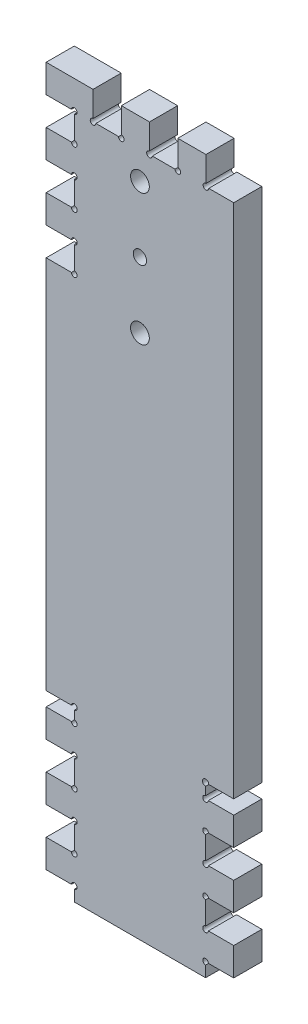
SolidWorks part; units mm, degrees
ref_plane "Ebene vorne" through (0, 0, 0) normal (0, 0, 1) x (1, 0, 0)
ref_plane "Ebene oben" through (0, 0, 0) normal (0, 1, 0) x (1, 0, 0)
ref_plane "Ebene rechts" through (0, 0, 0) normal (1, 0, 0) x (0, 0, -1)
sketch "Skizze1" plane through (0, 0, 0) normal (0, 0, 1) x (1, 0, 0)
  line L0 (0, 82.6) -> (13.5, 82.6)
  line L1 (0, 365.2705) -> (13.5, 365.2705)
  line L2 (15, 84.1) -> (15, 88.6)
  line L5 (0, 82.6) -> (0, 67.6)
  line L6 (0, 67.6) -> (13.5, 67.6)
  line L7 (15, 66.1) -> (15, 54)
  line L8 (13.5, 52.5) -> (0, 52.5)
  line L9 (0, 52.5) -> (0, 37.5)
  line L10 (0, 37.5) -> (13.5, 37.5)
  line L11 (15, 36) -> (15, 23.9)
  line L12 (85, 88.4) -> (85, 84.1)
  line L13 (0, 22.4) -> (0, 7.4)
  line L14 (13.5, 22.4) -> (0, 22.4)
  line L15 (0, 7.4) -> (13.5, 7.4)
  line L16 (86.7, 90.1) -> (100, 90.1)
  line L17 (86.5, 82.6) -> (100, 82.6)
  line L18 (100, 67.6) -> (86.5, 67.6)
  line L19 (85, 66.1) -> (85, 54)
  line L20 (86.5, 52.5) -> (100, 52.5)
  line L21 (100, 52.5) -> (100, 37.5)
  line L22 (100, 37.5) -> (86.5, 37.5)
  line L23 (85, 36) -> (85, 23.9)
  line L24 (100, 82.6) -> (100, 67.6)
  line L25 (86.5, 22.4) -> (100, 22.4)
  line L26 (100, 7.4) -> (86.5, 7.4)
  line L27 (100, 22.4) -> (100, 7.4)
  line L29 (15, 5.9) -> (15, 0)
  line L30 (85, 5.9) -> (85, 0)
  line L31 (85, 0) -> (15, 0)
  line L32 (0, 289.9705) -> (0, 90.1)
  line L33 (0, 90.1) -> (13.5, 90.1)
  line L34 (100, 90.1) -> (100, 365.4)
  line L35 (15, 291.4705) -> (15, 303.5705)
  line L36 (13.5, 350.1705) -> (0, 350.1705)
  line L37 (0, 305.0705) -> (0, 320.0705)
  line L39 (15, 321.5705) -> (15, 333.6705)
  line L40 (0, 335.1705) -> (13.5, 335.1705)
  line L41 (0, 335.1705) -> (0, 350.1705)
  line L42 (13.5, 320.0705) -> (0, 320.0705)
  line L43 (15, 351.6705) -> (15, 363.7705)
  line L44 (0, 305.0705) -> (13.5, 305.0705)
  line L45 (0, 365.2705) -> (0, 380.2705)
  line L46 (0, 380.2705) -> (25, 380.2705)
  line L47 (26.5, 365.2705) -> (38.6, 365.2705)
  line L48 (40.1, 366.7705) -> (40.1, 380.2705)
  line L49 (55.1, 380.2705) -> (54.9689, 366.7648)
  line L50 (40.1, 380.2705) -> (55.1, 380.2705)
  line L51 (56.6, 365.2705) -> (68.7, 365.2705)
  line L52 (70.2, 366.7705) -> (70.2, 380.2705)
  line L53 (85.2, 380.2705) -> (85.2, 366.9)
  line L54 (70.2, 380.2705) -> (85.2, 380.2705)
  line L55 (86.7, 365.4) -> (100, 365.4)
  line L56 (25, 366.7705) -> (25, 380.2705)
  line L57 (13.5, 289.9705) -> (0, 289.9705)
  arc A0 (13.5, 82.6) -> (15, 84.1) centre (15, 82.6) ccw
  arc A1 (13.5, 67.6) -> (15, 66.1) centre (15, 67.6) cw
  arc A2 (15, 54) -> (13.5, 52.5) centre (15, 52.5) cw
  arc A3 (13.5, 37.5) -> (15, 36) centre (15, 37.5) cw
  arc A4 (15, 23.9) -> (13.5, 22.4) centre (15, 22.4) cw
  arc A5 (13.5, 7.4) -> (15, 5.9) centre (15, 7.4) cw
  arc A6 (85, 84.1) -> (86.5, 82.6) centre (85, 82.6) ccw
  arc A7 (86.5, 67.6) -> (85, 66.1) centre (85, 67.6) ccw
  arc A8 (85, 54) -> (86.5, 52.5) centre (85, 52.5) ccw
  arc A9 (86.5, 37.5) -> (85, 36) centre (85, 37.5) ccw
  arc A10 (85, 23.9) -> (86.5, 22.4) centre (85, 22.4) ccw
  arc A11 (86.5, 7.4) -> (85, 5.9) centre (85, 7.4) ccw
  arc A12 (13.5, 289.9705) -> (15, 291.4705) centre (15, 289.9705) ccw
  arc A13 (13.5, 305.0705) -> (15, 303.5705) centre (15, 305.0705) cw
  arc A14 (13.5, 320.0705) -> (15, 321.5705) centre (15, 320.0705) ccw
  arc A15 (15, 333.6705) -> (13.5, 335.1705) centre (15, 335.1705) ccw
  arc A16 (13.5, 350.1705) -> (15, 351.6705) centre (15, 350.1705) ccw
  arc A17 (15, 363.7705) -> (13.5, 365.2705) centre (15, 365.2705) ccw
  arc A18 (25, 366.7705) -> (26.5, 365.2705) centre (25, 365.2705) ccw
  arc A19 (38.6, 365.2705) -> (40.1, 366.7705) centre (40.1, 365.2705) ccw
  arc A20 (54.9689, 366.7648) -> (56.6, 365.2705) centre (55.1, 365.2705) ccw
  arc A21 (68.7, 365.2705) -> (70.2, 366.7705) centre (70.2, 365.2705) ccw
  arc A22 (85.2, 366.9) -> (86.7, 365.4) centre (85.2, 365.4) ccw
  arc A23 (13.5, 90.1) -> (15, 88.6) centre (15, 90.1) cw
  arc A24 (86.7, 90.1) -> (85, 88.4) centre (85, 90.1) ccw
  dimension "D13" = 15
  dimension "D14" = 100
  dimension "D15" = 7.5
  dimension "D16" = 6
  dimension "D17" = 290.1705
  dimension "D18" = 14.8
  dimension "D12" = 1.5
  dimension "D19" = 1.5
  dimension "D20" = 1.5
  dimension "D21" = 1.5
  dimension "D22" = 1.5
  dimension "D23" = 1.5
  dimension "D36" = 1.5
  dimension "D37" = 1.5
  dimension "D38" = 1.5
  dimension "D39" = 1.5
  dimension "D40" = 1.5
  dimension "D41" = 1.5
  dimension "D42" = 1.5
  dimension "D43" = 1.5
  dimension "D44" = 1.5
  dimension "D45" = 1.5
  dimension "D46" = 1.5
  dimension "D3" = 15
  dimension "D5" = 15
  dimension "D6" = 15
  dimension "D7" = 15.1
  dimension "D8" = 15.1
  dimension "D9" = 15
  dimension "D10" = 15
  dimension "D11" = 15
  dimension "D24" = 15.1
  dimension "D25" = 15.1
  dimension "D28" = 15.1
  dimension "D29" = 15
  dimension "D30" = 15.1
  dimension "D31" = 15
  dimension "D32" = 15.1
  dimension "D33" = 100
  dimension "D34" = 10
  dimension "D35" = 15
  dimension "D47" = 15
  dimension "D48" = 15
  dimension "D49" = 15
  dimension "D51" = 13.5
  dimension "D52" = 15
  dimension "D53" = 12.1
  dimension "D54" = 13.5
  dimension "D55" = 12.1
  dimension "D56" = 13.5
  dimension "D57" = 15
  dimension "D58" = 15
  dimension "D59" = 5.9
  dimension "D60" = 15.1
  dimension "D61" = 15.1
  dimension "D62" = 7.4
extrude "Aufsatz-Linear austragen1" add sketch "Skizze1" along normal blind 15
sketch "Skizze2" plane through (0, 0, 0) normal (0, 0, -1) x (-1, 0, 0)
  line L0 (-100, 90.1) -> (-100, 365.4) construction
  line L1 (-56.6, 365.2705) -> (-68.7, 365.2705) construction
  circle A0 centre (-50, 350.2705) radius 5.05
  circle A1 centre (-50, 280.2705) radius 5.05
  dimension "D1" = 10.1
  dimension "D2" = 10.1
  dimension "D3" = 50
  dimension "D4" = 70
  dimension "D5" = 15
sketch "Skizze3" plane through (0, 0, 0) normal (0, 0, -1) x (-1, 0, 0)
  line L0 (-100, 90.1) -> (-100, 365.4) construction
  line L1 (-56.6, 365.2705) -> (-68.7, 365.2705) construction
  circle A0 centre (-50, 315.2705) radius 3.55
  dimension "D1" = 50
  dimension "D2" = 7.1
  dimension "D3" = 50
extrude "Schnitt-Linear austragen3" cut sketch "Skizze3" against normal blind 17.5
sketch "Skizze4" plane through (0, 0, 15) normal (0, 0, 1) x (1, 0, 0)
  line L2 (68.7, 365.2705) -> (56.6, 365.2705) construction
  line L3 (100, 90.1) -> (100, 365.4) construction
  circle A0 centre (50, 280.2705) radius 5
  circle A1 centre (50, 350.2705) radius 5
  point P6 (62.65, 365.2705)
  point P10 (49.1575, 281.6592)
  dimension "D1" = 10
  dimension "D2" = 10
  dimension "D3" = 15
  dimension "D4" = 50
  dimension "D5" = 50
  dimension "D6" = 70
extrude "Schnitt-Linear austragen4" cut sketch "Skizze4" against normal blind 7.5
